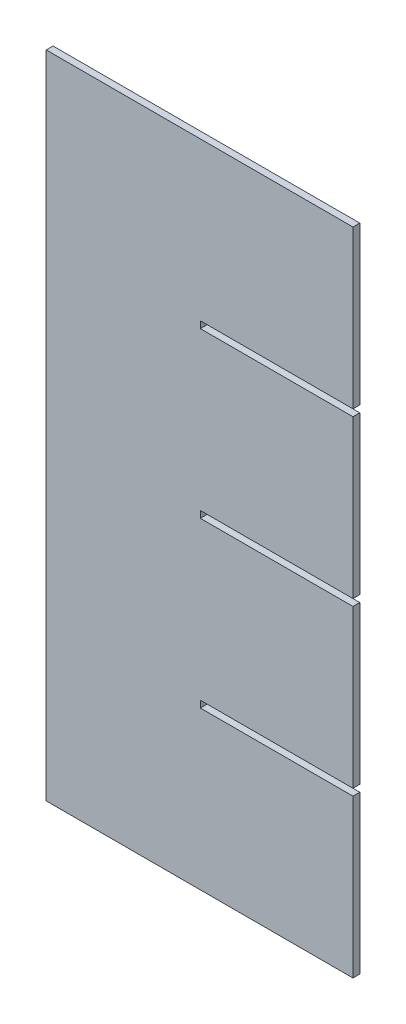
SolidWorks part; units mm, degrees
ref_plane "Front Plane" through (0, 0, 0) normal (0, 0, 1) x (1, 0, 0)
ref_plane "Top Plane" through (0, 0, 0) normal (0, 1, 0) x (1, 0, 0)
ref_plane "Right Plane" through (0, 0, 0) normal (1, 0, 0) x (0, 0, -1)
sketch "Sketch1" plane through (0, 0, 0) normal (0, 0, 1) x (1, 0, 0)
  line L0 (0, 0) -> (160.274, 0)
  line L1 (160.274, 0) -> (160.274, 82.296)
  line L2 (160.274, 82.296) -> (80.518, 82.296)
  line L3 (80.518, 82.296) -> (80.518, 85.852)
  line L4 (80.518, 85.852) -> (160.274, 85.852)
  line L5 (160.274, 85.852) -> (160.274, 168.148)
  line L6 (160.274, 168.148) -> (80.518, 168.148)
  line L7 (80.518, 168.148) -> (80.518, 171.704)
  line L8 (80.518, 171.704) -> (160.274, 171.704)
  line L9 (160.274, 171.704) -> (160.274, 254)
  line L10 (160.274, 254) -> (80.518, 254)
  line L11 (80.518, 254) -> (80.518, 257.556)
  line L12 (80.518, 257.556) -> (160.274, 257.556)
  line L13 (160.274, 257.556) -> (160.274, 339.852)
  line L14 (160.274, 339.852) -> (0, 339.852)
  line L15 (0, 339.852) -> (0, 0)
  dimension "D1" = 160.274
  dimension "D2" = 82.296
  dimension "D3" = 79.756
  dimension "D4" = 3.556
  dimension "D5" = 79.756
  dimension "D6" = 160.274
  dimension "D7" = 339.852
extrude "Boss-Extrude1" add sketch "Sketch1" along normal blind 3.556
